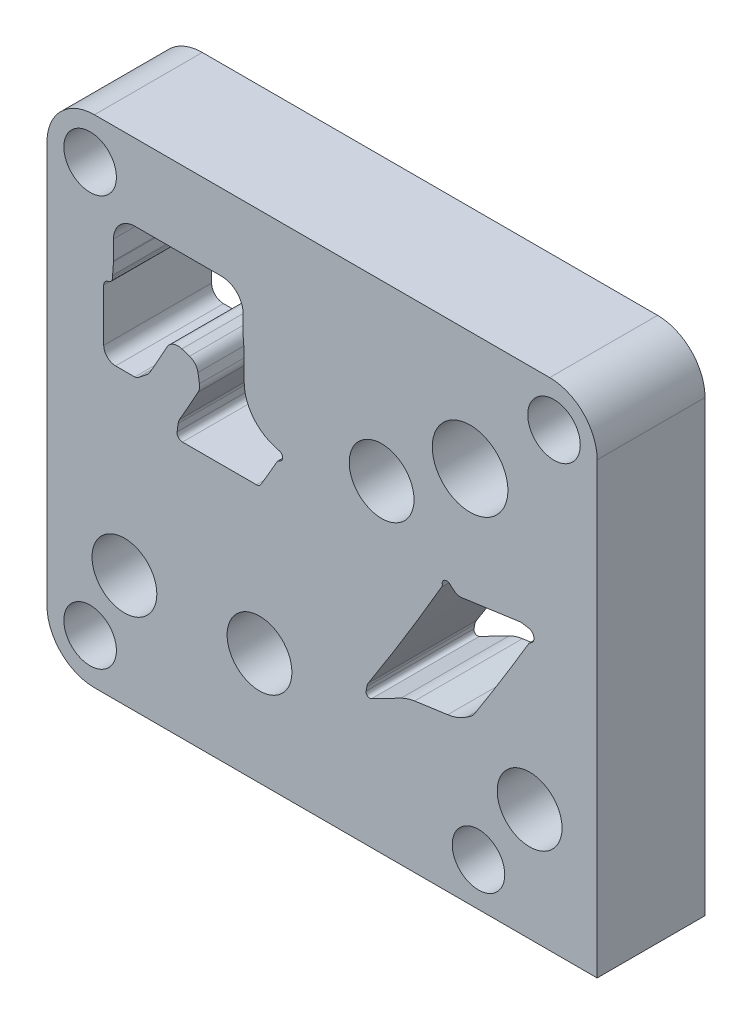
SolidWorks part; units mm, degrees
ref_plane "Front" through (0, 0, 0) normal (0, 0, 1) x (1, 0, 0)
ref_plane "Top" through (0, 0, 0) normal (0, 1, 0) x (1, 0, 0)
ref_plane "Right" through (0, 0, 0) normal (1, 0, 0) x (0, 0, -1)
ref_plane "Plane1"
sketch "Sketch1" plane through (0, 0, 0) normal (0, 0, 1) x (1, 0, 0)
  line L0 (-948.5827, 37.7447) -> (-922.8937, 74.4323) construction
  line L1 (-946.7114, 0.105) -> (-925.0793, -15.0419) construction
  line L2 (-867.3291, 76.3036) -> (-857.9601, 69.7433) construction
  line L3 (-905.6228, -11.6112) -> (-856.0888, 59.1307) construction
  line L4 (-916.6518, 77.6816) -> (-871.6997, 77.6816) construction
  line L5 (-949.9607, 33.374) -> (-949.9607, 6.347) construction
  line L6 (-896.62, 0) -> (-936.371, 0) construction
  line L7 (-921.2966, 21.3588) -> (-888.5153, 68.1753) construction
  line L8 (-928.7943, 53.4507) -> (-890.1459, 26.3888) construction
  line L9 (-896.62, -85.471) -> (-896.62, 85.471) construction
  line L11 (-998.0309, 53.975) -> (-939.2984, 53.975) construction
  line L12 (-865.5685, -19.05) -> (-1013.5235, -19.05)
  line L13 (-865.5685, -19.05) -> (-865.5685, 113.03)
  line L14 (-879.5385, 127) -> (-1013.5235, 127)
  line L15 (-1027.4935, -5.08) -> (-1027.4935, 113.03)
  line L16 (-946.531, 115.4783) -> (-946.531, 28.0626) construction
  line L17 (-936.371, -85.471) -> (-936.371, 85.471) construction
  line L18 (-936.371, 0) -> (-976.122, 0) construction
  arc A0 (-925.0793, -15.0419) -> (-905.6228, -11.6112) centre (-917.0664, -3.5984) ccw construction
  arc A1 (-857.9601, 69.7433) -> (-856.0888, 59.1307) centre (-862.3307, 63.5014) cw construction
  arc A4 (-871.6997, 77.6816) -> (-867.3291, 76.3036) centre (-871.6997, 70.0616) cw construction
  arc A5 (-916.6518, 77.6816) -> (-922.8937, 74.4323) centre (-916.6518, 70.0616) ccw construction
  arc A6 (-949.9607, 6.347) -> (-946.7114, 0.105) centre (-942.3407, 6.347) ccw construction
  arc A7 (-949.9607, 33.374) -> (-948.5827, 37.7447) centre (-942.3407, 33.374) cw construction
  arc A8 (-1013.5235, -19.05) -> (-1027.4935, -5.08) centre (-1013.5235, -5.08) cw
  arc A9 (-865.5685, 113.03) -> (-879.5385, 127) centre (-879.5385, 113.03) ccw
  arc A10 (-1013.5235, 127) -> (-1027.4935, 113.03) centre (-1013.5235, 113.03) ccw
  point P8 (-908.685, 39.37)
  point P12 (-913.6357, -23.0548)
  point P15 (-851.7181, 65.3727)
  point P18 (-903.7343, 101.7948)
  point P39 (-946.531, 53.975)
  point P45 (-1027.4935, -19.05)
  point P48 (-865.5685, 127)
  point P53 (-865.5685, -19.05)
extrude "Boss-Extrude1" add sketch "Sketch1" against normal blind 31.75 flip side to cut
ref_plane "Plane2 QU250515L_Punch1[Mounted in the strip]-2"
ref_plane "Plane1 QU250515L_Punch1[Mounted in the strip]-2"
sketch "Sketch2 QU250515L_Punch1[Mounted in the strip]-2" plane through (0, 0, 0) normal (0, 0, 1) x (1, 0, 0)
  line L0 (-907.8441, 58.3577) -> (-909.2124, 59.493)
  line L1 (-888.4186, 60.0401) -> (-905.3749, 57.6571)
  line L2 (-885.7407, 59.7257) -> (-887.4254, 60.0228)
  line L3 (-904.0985, 28.5403) -> (-902.8478, 29.4112)
  line L4 (-919.3415, 25.0155) -> (-909.5881, 26.3862)
  line L5 (-932.1542, 19.2003) -> (-923.4041, 23.7218)
  line L6 (-933.0211, 21.2739) -> (-933.2533, 20.0156)
  line L7 (-933.0211, 21.2739) -> (-933.2533, 20.0156)
  line L8 (-932.1542, 19.2003) -> (-923.4041, 23.7218)
  line L9 (-919.3415, 25.0155) -> (-909.5881, 26.3862)
  line L10 (-904.0985, 28.5403) -> (-902.8478, 29.4112)
  line L11 (-885.7407, 59.7257) -> (-887.4254, 60.0228)
  line L12 (-888.4186, 60.0401) -> (-905.3749, 57.6571)
  line L13 (-907.8441, 58.3577) -> (-909.2124, 59.493)
  arc A0 (-932.5852, 22.3726) -> (-911.0334, 57.6234) centre (-1653.9165, 487.596) ccw
  arc A1 (-911.0334, 57.6234) -> (-910.842, 58.5901) centre (-912.3524, 58.3868) ccw
  arc A2 (-909.2124, 59.493) -> (-910.842, 58.5901) centre (-909.851, 58.7234) ccw
  arc A3 (-907.8441, 58.3577) -> (-905.3749, 57.6571) centre (-905.8168, 60.8012) ccw
  arc A4 (-887.4254, 60.0228) -> (-888.4186, 60.0401) centre (-887.9768, 56.896) ccw
  arc A5 (-885.3407, 56.8535) -> (-885.7407, 59.7257) centre (-886.0054, 58.2249) ccw
  arc A6 (-885.3407, 56.8535) -> (-885.9872, 56.2588) centre (-884.6759, 55.4821) ccw
  arc A7 (-902.0249, 30.2655) -> (-885.9872, 56.2588) centre (-1614.1655, 487.596) ccw
  arc A8 (-902.8478, 29.4112) -> (-902.0249, 30.2655) centre (-904.5895, 31.9125) ccw
  arc A9 (-909.5881, 26.3862) -> (-904.0985, 28.5403) centre (-911.3556, 38.9626) ccw
  arc A10 (-919.3415, 25.0155) -> (-923.4041, 23.7218) centre (-917.574, 12.4391) ccw
  arc A11 (-933.2533, 20.0156) -> (-932.1542, 19.2003) centre (-932.504, 19.8773) ccw
  arc A12 (-932.5852, 22.3726) -> (-933.0211, 21.2739) centre (-930.0237, 20.7206) ccw
  arc A13 (-932.5852, 22.3726) -> (-933.0211, 21.2739) centre (-930.0237, 20.7206) ccw
  arc A14 (-933.2533, 20.0156) -> (-932.1542, 19.2003) centre (-932.504, 19.8773) ccw
  arc A15 (-919.3415, 25.0155) -> (-923.4041, 23.7218) centre (-917.574, 12.4391) ccw
  arc A16 (-909.5881, 26.3862) -> (-904.0985, 28.5403) centre (-911.3556, 38.9626) ccw
  arc A17 (-902.8478, 29.4112) -> (-902.0249, 30.2655) centre (-904.5895, 31.9125) ccw
  arc A18 (-902.0249, 30.2655) -> (-885.9872, 56.2588) centre (-1614.1655, 487.596) ccw
  arc A19 (-885.3407, 56.8535) -> (-885.9872, 56.2588) centre (-884.6759, 55.4821) ccw
  arc A20 (-885.3407, 56.8535) -> (-885.7407, 59.7257) centre (-886.0054, 58.2249) ccw
  arc A21 (-887.4254, 60.0228) -> (-888.4186, 60.0401) centre (-887.9768, 56.896) ccw
  arc A22 (-907.8441, 58.3577) -> (-905.3749, 57.6571) centre (-905.8168, 60.8012) ccw
  arc A23 (-909.2124, 59.493) -> (-910.842, 58.5901) centre (-909.851, 58.7234) ccw
  arc A24 (-911.0334, 57.6234) -> (-910.842, 58.5901) centre (-912.3524, 58.3868) ccw
  arc A25 (-932.5852, 22.3726) -> (-911.0334, 57.6234) centre (-1653.9165, 487.596) ccw
  circle A26 centre (-896.62, 52.07) radius 1.2065
  circle A27 centre (-904.24, 45.72) radius 5.3594
  circle A28 centre (-911.86, 35.56) radius 5.3594
  circle A40 centre (-896.62, 52.07) radius 1.2065
  circle A44 centre (-911.86, 35.56) radius 5.3594
  circle A45 centre (-904.24, 45.72) radius 5.3594
sketch "Sketch1 QU250515L_Punch1[Mounted in the strip]-2" plane through (0, 0, -4.7625) normal (0, 0, 1) x (1, 0, 0)
  line L7 (-933.3358, 21.332) -> (-933.5681, 20.0737)
  line L8 (-932.0073, 18.916) -> (-923.2572, 23.4374)
  line L9 (-919.297, 24.6985) -> (-909.5436, 26.0693)
  line L10 (-903.9156, 28.2777) -> (-902.665, 29.1485)
  line L11 (-885.6852, 60.0409) -> (-887.3698, 60.3379)
  line L12 (-888.4632, 60.357) -> (-905.4194, 57.974)
  line L13 (-907.6398, 58.604) -> (-909.0081, 59.7393)
  line L14 (-933.3358, 21.332) -> (-933.5681, 20.0737)
  line L15 (-932.0073, 18.916) -> (-923.2572, 23.4374)
  line L16 (-919.297, 24.6985) -> (-909.5436, 26.0693)
  line L17 (-903.9156, 28.2777) -> (-902.665, 29.1485)
  line L18 (-885.6852, 60.0409) -> (-887.3698, 60.3379)
  line L19 (-888.4632, 60.357) -> (-905.4194, 57.974)
  line L20 (-907.6398, 58.604) -> (-909.0081, 59.7393)
  arc A13 (-932.8541, 22.5461) -> (-933.3358, 21.332) centre (-930.0237, 20.7206) ccw
  arc A14 (-933.5681, 20.0737) -> (-932.0073, 18.916) centre (-932.504, 19.8773) ccw
  arc A15 (-919.297, 24.6985) -> (-923.2572, 23.4374) centre (-917.574, 12.4391) ccw
  arc A16 (-909.5436, 26.0693) -> (-903.9156, 28.2777) centre (-911.3556, 38.9626) ccw
  arc A17 (-902.665, 29.1485) -> (-901.7556, 30.0926) centre (-904.5895, 31.9125) ccw
  arc A18 (-901.7556, 30.0926) -> (-885.7118, 56.0957) centre (-1614.1655, 487.596) ccw
  arc A19 (-885.2011, 56.5655) -> (-885.7118, 56.0957) centre (-884.6759, 55.4821) ccw
  arc A20 (-885.2011, 56.5655) -> (-885.6852, 60.0409) centre (-886.0054, 58.2249) ccw
  arc A21 (-887.3698, 60.3379) -> (-888.4632, 60.357) centre (-887.9768, 56.896) ccw
  arc A22 (-907.6398, 58.604) -> (-905.4194, 57.974) centre (-905.8168, 60.8012) ccw
  arc A23 (-909.0081, 59.7393) -> (-911.1592, 58.5474) centre (-909.851, 58.7234) ccw
  arc A24 (-911.3104, 57.7837) -> (-911.1592, 58.5474) centre (-912.3524, 58.3868) ccw
  arc A25 (-932.8541, 22.5461) -> (-911.3104, 57.7837) centre (-1653.9165, 487.596) ccw
  arc A26 (-932.8541, 22.5461) -> (-933.3358, 21.332) centre (-930.0237, 20.7206) ccw
  arc A27 (-933.5681, 20.0737) -> (-932.0073, 18.916) centre (-932.504, 19.8773) ccw
  arc A28 (-919.297, 24.6985) -> (-923.2572, 23.4374) centre (-917.574, 12.4391) ccw
  arc A29 (-909.5436, 26.0693) -> (-903.9156, 28.2777) centre (-911.3556, 38.9626) ccw
  arc A30 (-902.665, 29.1485) -> (-901.7556, 30.0926) centre (-904.5895, 31.9125) ccw
  arc A31 (-901.7556, 30.0926) -> (-885.7118, 56.0957) centre (-1614.1655, 487.596) ccw
  arc A32 (-885.2011, 56.5655) -> (-885.7118, 56.0957) centre (-884.6759, 55.4821) ccw
  arc A33 (-885.2011, 56.5655) -> (-885.6852, 60.0409) centre (-886.0054, 58.2249) ccw
  arc A34 (-887.3698, 60.3379) -> (-888.4632, 60.357) centre (-887.9768, 56.896) ccw
  arc A35 (-907.6398, 58.604) -> (-905.4194, 57.974) centre (-905.8168, 60.8012) ccw
  arc A36 (-909.0081, 59.7393) -> (-911.1592, 58.5474) centre (-909.851, 58.7234) ccw
  arc A37 (-911.3104, 57.7837) -> (-911.1592, 58.5474) centre (-912.3524, 58.3868) ccw
  arc A38 (-932.8541, 22.5461) -> (-911.3104, 57.7837) centre (-1653.9165, 487.596) ccw
ref_plane "Plane2 QU250515L_Punch4[Mounted in the strip]-1"
ref_plane "Plane1 QU250515L_Punch4[Mounted in the strip]-1"
sketch "Sketch2 QU250515L_Punch4[Mounted in the strip]-1" plane through (0, 0, 0) normal (0, 0, 1) x (1, 0, 0)
  line L0 (-976.122, 104.521) -> (-1001.522, 104.521)
  line L1 (-987.6114, 56.8535) -> (-965.8621, 56.8535)
  line L2 (-988.5754, 60.5652) -> (-988.8709, 58.2868)
  line L3 (-982.7401, 76.596) -> (-982.3045, 73.9476)
  line L4 (-987.6832, 80.4921) -> (-985.427, 79.7432)
  line L5 (-1000.8813, 66.6897) -> (-998.2554, 68.7387)
  line L6 (-1004.697, 66.421) -> (-1001.6626, 66.421)
  line L7 (-1007.872, 98.171) -> (-1007.872, 69.596)
  line L8 (-969.772, 80.8774) -> (-969.772, 98.171)
  line L9 (-959.1552, 68.2309) -> (-960.8063, 68.7388)
  line L10 (-959.1552, 68.2309) -> (-960.8063, 68.7388)
  line L11 (-969.772, 80.8774) -> (-969.772, 98.171)
  line L12 (-1007.872, 98.171) -> (-1007.872, 69.596)
  line L13 (-1004.697, 66.421) -> (-1001.6626, 66.421)
  line L14 (-1000.8813, 66.6897) -> (-998.2554, 68.7387)
  line L15 (-987.6832, 80.4921) -> (-985.427, 79.7432)
  line L16 (-982.7401, 76.596) -> (-982.3045, 73.9476)
  line L17 (-988.5754, 60.5652) -> (-988.8709, 58.2868)
  line L18 (-987.6114, 56.8535) -> (-965.8621, 56.8535)
  line L19 (-976.122, 104.521) -> (-1001.522, 104.521)
  arc A0 (-1001.522, 104.521) -> (-1007.872, 98.171) centre (-1001.522, 98.171) ccw
  arc A1 (-969.772, 98.171) -> (-976.122, 104.521) centre (-976.122, 98.171) ccw
  arc A2 (-988.8709, 58.2868) -> (-987.6114, 56.8535) centre (-987.6114, 58.1235) ccw
  arc A3 (-988.199, 61.6856) -> (-988.5754, 60.5652) centre (-985.5527, 60.1732) ccw
  arc A4 (-988.199, 61.6856) -> (-982.7533, 71.3587) centre (-1733.4185, 487.596) ccw
  arc A5 (-982.7533, 71.3587) -> (-982.3045, 73.9476) centre (-986.2515, 73.2984) ccw
  arc A6 (-982.7401, 76.596) -> (-985.427, 79.7432) centre (-986.6871, 75.9469) ccw
  arc A7 (-987.6832, 80.4921) -> (-992.4453, 78.6287) centre (-988.9433, 76.6958) ccw
  arc A8 (-997.4801, 69.6365) -> (-992.4453, 78.6287) centre (-1733.4185, 487.596) ccw
  arc A9 (-998.2554, 68.7387) -> (-997.4801, 69.6365) centre (-1000.1305, 71.1417) ccw
  arc A10 (-1001.6626, 66.421) -> (-1000.8813, 66.6897) centre (-1001.6626, 67.691) ccw
  arc A11 (-1007.872, 69.596) -> (-1004.697, 66.421) centre (-1004.697, 69.596) ccw
  arc A12 (-969.772, 80.8774) -> (-960.8063, 68.7388) centre (-957.072, 80.8774) ccw
  arc A13 (-959.1529, 66.32) -> (-959.1552, 68.2309) centre (-959.4493, 67.2751) ccw
  arc A14 (-959.1529, 66.32) -> (-960.0222, 65.6244) centre (-958.7011, 64.8645) ccw
  arc A15 (-964.7683, 57.478) -> (-960.0222, 65.6244) centre (-1693.6675, 487.596) ccw
  arc A16 (-965.8621, 56.8535) -> (-964.7683, 57.478) centre (-965.8621, 58.1235) ccw
  arc A17 (-965.8621, 56.8535) -> (-964.7683, 57.478) centre (-965.8621, 58.1235) ccw
  arc A18 (-964.7683, 57.478) -> (-960.0222, 65.6244) centre (-1693.6675, 487.596) ccw
  arc A19 (-959.1529, 66.32) -> (-960.0222, 65.6244) centre (-958.7011, 64.8645) ccw
  arc A20 (-959.1529, 66.32) -> (-959.1552, 68.2309) centre (-959.4493, 67.2751) ccw
  arc A21 (-969.772, 80.8774) -> (-960.8063, 68.7388) centre (-957.072, 80.8774) ccw
  arc A22 (-1007.872, 69.596) -> (-1004.697, 66.421) centre (-1004.697, 69.596) ccw
  arc A23 (-1001.6626, 66.421) -> (-1000.8813, 66.6897) centre (-1001.6626, 67.691) ccw
  arc A24 (-998.2554, 68.7387) -> (-997.4801, 69.6365) centre (-1000.1305, 71.1417) ccw
  arc A25 (-997.4801, 69.6365) -> (-992.4453, 78.6287) centre (-1733.4185, 487.596) ccw
  arc A26 (-987.6832, 80.4921) -> (-992.4453, 78.6287) centre (-988.9433, 76.6958) ccw
  arc A27 (-982.7401, 76.596) -> (-985.427, 79.7432) centre (-986.6871, 75.9469) ccw
  arc A28 (-982.7533, 71.3587) -> (-982.3045, 73.9476) centre (-986.2515, 73.2984) ccw
  arc A29 (-988.199, 61.6856) -> (-982.7533, 71.3587) centre (-1733.4185, 487.596) ccw
  arc A30 (-988.199, 61.6856) -> (-988.5754, 60.5652) centre (-985.5527, 60.1732) ccw
  arc A31 (-988.8709, 58.2868) -> (-987.6114, 56.8535) centre (-987.6114, 58.1235) ccw
  arc A32 (-969.772, 98.171) -> (-976.122, 104.521) centre (-976.122, 98.171) ccw
  arc A33 (-1001.522, 104.521) -> (-1007.872, 98.171) centre (-1001.522, 98.171) ccw
  arc A34 (-974.9155, 76.2) -> (-974.9155, 76.2) centre (-976.122, 76.2) ccw
  arc A35 (-968.9846, 65.532) -> (-968.9846, 65.532) centre (-974.344, 65.532) ccw
  circle A36 centre (-979.297, 94.996) radius 5.3594
  circle A37 centre (-998.347, 94.996) radius 5.3594
sketch "Sketch1 QU250515L_Punch4[Mounted in the strip]-1" plane through (0, 0, -4.7625) normal (0, 0, 1) x (1, 0, 0)
  line L0 (-1004.697, 66.421) -> (-1001.6626, 66.421) construction
  line L1 (-1000.8813, 66.6897) -> (-998.2554, 68.7387) construction
  line L2 (-987.6832, 80.4921) -> (-985.427, 79.7432) construction
  line L3 (-982.7401, 76.596) -> (-982.3045, 73.9476) construction
  line L4 (-988.5754, 60.5652) -> (-988.8709, 58.2868) construction
  line L5 (-987.6114, 56.8535) -> (-965.8621, 56.8535) construction
  line L6 (-959.1552, 68.2309) -> (-960.8063, 68.7388) construction
  line L7 (-1004.697, 66.421) -> (-1001.6626, 66.421) construction
  line L8 (-1000.8813, 66.6897) -> (-998.2554, 68.7387) construction
  line L9 (-987.6832, 80.4921) -> (-985.427, 79.7432) construction
  line L30 (-982.7401, 76.596) -> (-982.3045, 73.9476) construction
  line L31 (-988.5754, 60.5652) -> (-988.8709, 58.2868) construction
  line L32 (-987.6114, 56.8535) -> (-965.8621, 56.8535) construction
  line L33 (-959.1552, 68.2309) -> (-960.8063, 68.7388) construction
  line L34 (-969.772, 92.419) -> (-969.772, 80.8774) construction
  line L35 (-969.772, 80.8774) -> (-969.772, 98.171) construction
  line L36 (-1007.872, 69.596) -> (-1007.872, 92.4078) construction
  line L37 (-1007.872, 98.171) -> (-1007.872, 69.596) construction
  line L38 (-1007.8974, 92.4301) -> (-1007.8974, 98.171) construction
  line L39 (-959.0611, 68.5368) -> (-960.7122, 69.0447)
  line L40 (-987.6114, 56.5334) -> (-965.8621, 56.5334)
  line L41 (-988.8928, 60.6063) -> (-989.1882, 58.3279)
  line L42 (-983.0559, 76.5441) -> (-982.6203, 73.8957)
  line L43 (-987.784, 80.1884) -> (-985.5278, 79.4394)
  line L44 (-1000.6844, 66.4374) -> (-998.0586, 68.4864)
  line L45 (-1004.697, 66.101) -> (-1001.6626, 66.101)
  line L46 (-969.7466, 98.171) -> (-969.7466, 92.5848) construction
  line L47 (-1007.872, 92.4301) -> (-1007.872, 98.171) construction
  line L48 (-969.772, 98.171) -> (-969.772, 92.5848) construction
  line L49 (-976.122, 104.521) -> (-1001.522, 104.521) construction
  line L50 (-976.122, 104.521) -> (-1001.522, 104.521) construction
  line L51 (-1007.8974, 92.5982) -> (-1007.8974, 98.171)
  line L52 (-976.122, 104.5464) -> (-1001.522, 104.5464)
  line L53 (-969.7466, 98.171) -> (-969.7466, 92.5982)
  line L54 (-1008.192, 69.596) -> (-1008.192, 92.4078) construction
  line L55 (-969.452, 92.419) -> (-969.452, 80.8774) construction
  line L56 (-1008.192, 69.596) -> (-1008.192, 88.5038)
  line L57 (-969.452, 88.5038) -> (-969.452, 80.8774)
  line L58 (-1008.1811, 88.7878) -> (-1007.9084, 92.3142)
  line L59 (-969.7356, 92.3142) -> (-969.4629, 88.7878)
  arc A0 (-1007.872, 69.596) -> (-1004.697, 66.421) centre (-1004.697, 69.596) ccw construction
  arc A1 (-1001.6626, 66.421) -> (-1000.8813, 66.6897) centre (-1001.6626, 67.691) ccw construction
  arc A2 (-998.2554, 68.7387) -> (-997.4801, 69.6365) centre (-1000.1305, 71.1417) ccw construction
  arc A3 (-997.4801, 69.6365) -> (-992.4453, 78.6287) centre (-1733.4185, 487.596) ccw construction
  arc A4 (-987.6832, 80.4921) -> (-992.4453, 78.6287) centre (-988.9433, 76.6958) ccw construction
  arc A5 (-982.7401, 76.596) -> (-985.427, 79.7432) centre (-986.6871, 75.9469) ccw construction
  arc A6 (-982.7533, 71.3587) -> (-982.3045, 73.9476) centre (-986.2515, 73.2984) ccw construction
  arc A7 (-988.199, 61.6856) -> (-982.7533, 71.3587) centre (-1733.4185, 487.596) ccw construction
  arc A8 (-988.199, 61.6856) -> (-988.5754, 60.5652) centre (-985.5527, 60.1732) ccw construction
  arc A9 (-988.8709, 58.2868) -> (-987.6114, 56.8535) centre (-987.6114, 58.1235) ccw construction
  arc A10 (-965.8621, 56.8535) -> (-964.7683, 57.478) centre (-965.8621, 58.1235) ccw construction
  arc A11 (-964.7683, 57.478) -> (-960.0222, 65.6244) centre (-1693.6675, 487.596) ccw construction
  arc A12 (-959.1529, 66.32) -> (-960.0222, 65.6244) centre (-958.7011, 64.8645) ccw construction
  arc A13 (-959.1529, 66.32) -> (-959.1552, 68.2309) centre (-959.4493, 67.2751) ccw construction
  arc A14 (-969.772, 80.8774) -> (-960.8063, 68.7388) centre (-957.072, 80.8774) ccw construction
  arc A15 (-1007.872, 69.596) -> (-1004.697, 66.421) centre (-1004.697, 69.596) ccw construction
  arc A16 (-1001.6626, 66.421) -> (-1000.8813, 66.6897) centre (-1001.6626, 67.691) ccw construction
  arc A18 (-998.2554, 68.7387) -> (-997.4801, 69.6365) centre (-1000.1305, 71.1417) ccw construction
  arc A19 (-997.4801, 69.6365) -> (-992.4453, 78.6287) centre (-1733.4185, 487.596) ccw construction
  arc A20 (-987.6832, 80.4921) -> (-992.4453, 78.6287) centre (-988.9433, 76.6958) ccw construction
  arc A23 (-982.7401, 76.596) -> (-985.427, 79.7432) centre (-986.6871, 75.9469) ccw construction
  arc A24 (-982.7533, 71.3587) -> (-982.3045, 73.9476) centre (-986.2515, 73.2984) ccw construction
  arc A27 (-988.199, 61.6856) -> (-982.7533, 71.3587) centre (-1733.4185, 487.596) ccw construction
  arc A28 (-988.199, 61.6856) -> (-988.5754, 60.5652) centre (-985.5527, 60.1732) ccw construction
  arc A32 (-988.8709, 58.2868) -> (-987.6114, 56.8535) centre (-987.6114, 58.1235) ccw construction
  arc A33 (-965.8621, 56.8535) -> (-964.7683, 57.478) centre (-965.8621, 58.1235) ccw construction
  arc A51 (-964.7683, 57.478) -> (-960.0222, 65.6244) centre (-1693.6675, 487.596) ccw construction
  arc A52 (-959.1529, 66.32) -> (-960.0222, 65.6244) centre (-958.7011, 64.8645) ccw construction
  arc A53 (-959.1529, 66.32) -> (-959.1552, 68.2309) centre (-959.4493, 67.2751) ccw construction
  arc A54 (-969.772, 80.8774) -> (-960.8063, 68.7388) centre (-957.072, 80.8774) ccw construction
  arc A55 (-969.452, 80.8774) -> (-960.7122, 69.0447) centre (-957.072, 80.8774) ccw
  arc A56 (-959.058, 66.0144) -> (-959.0611, 68.5368) centre (-959.4493, 67.2751) ccw
  arc A57 (-959.058, 66.0144) -> (-959.7448, 65.4648) centre (-958.7011, 64.8645) ccw
  arc A58 (-964.4927, 57.3154) -> (-959.7448, 65.4648) centre (-1693.6675, 487.596) ccw
  arc A59 (-965.8621, 56.5334) -> (-964.4927, 57.3154) centre (-965.8621, 58.1235) ccw
  arc A60 (-989.1882, 58.3279) -> (-987.6114, 56.5334) centre (-987.6114, 58.1235) ccw
  arc A61 (-988.4769, 61.8444) -> (-988.8928, 60.6063) centre (-985.5527, 60.1732) ccw
  arc A62 (-988.4769, 61.8444) -> (-983.0332, 71.5139) centre (-1733.4185, 487.596) ccw
  arc A63 (-983.0332, 71.5139) -> (-982.6203, 73.8957) centre (-986.2515, 73.2984) ccw
  arc A64 (-983.0559, 76.5441) -> (-985.5278, 79.4394) centre (-986.6871, 75.9469) ccw
  arc A65 (-987.784, 80.1884) -> (-992.1652, 78.474) centre (-988.9433, 76.6958) ccw
  arc A66 (-997.2018, 69.4784) -> (-992.1652, 78.474) centre (-1733.4185, 487.596) ccw
  arc A67 (-998.0586, 68.4864) -> (-997.2018, 69.4784) centre (-1000.1305, 71.1417) ccw
  arc A68 (-1001.6626, 66.101) -> (-1000.6844, 66.4374) centre (-1001.6626, 67.691) ccw
  arc A69 (-1008.192, 69.596) -> (-1004.697, 66.101) centre (-1004.697, 69.596) ccw
  arc A70 (-969.772, 98.171) -> (-976.122, 104.521) centre (-976.122, 98.171) ccw construction
  arc A71 (-1001.522, 104.521) -> (-1007.872, 98.171) centre (-1001.522, 98.171) ccw construction
  arc A72 (-969.772, 98.171) -> (-976.122, 104.521) centre (-976.122, 98.171) ccw construction
  arc A73 (-1001.522, 104.521) -> (-1007.872, 98.171) centre (-1001.522, 98.171) ccw construction
  arc A74 (-1001.522, 104.5464) -> (-1007.8974, 98.171) centre (-1001.522, 98.171) ccw
  arc A75 (-969.7466, 98.171) -> (-976.122, 104.5464) centre (-976.122, 98.171) ccw
  arc A76 (-1008.192, 88.5038) -> (-1008.1811, 88.7878) centre (-1004.509, 88.5038) cw
  arc A77 (-1007.8974, 92.5982) -> (-1007.9084, 92.3142) centre (-1011.5804, 92.5982) cw
  arc A78 (-969.7466, 92.5982) -> (-969.7356, 92.3142) centre (-966.0636, 92.5982) ccw
  arc A79 (-969.452, 88.5038) -> (-969.4629, 88.7878) centre (-973.135, 88.5038) ccw
  point P95 (-1008.192, 88.646)
  point P100 (-1007.8974, 92.456)
hole_wizard "Hole1" positions "Point_Sketch" profile "Profil_Sketch" hole size "Ø0.15" standard "ISO"
sketch "Point_Sketch" plane through (-1008.3513, 24.5711, 0) normal (0, 0, -1) x (1, 0, 0)
  point P0 (3.6543, 10.6011)
  point P2 (43.4053, 10.6011)
  point P4 (122.9073, 10.6011)
  point P6 (79.3463, -51.3241)
  point P8 (105.3813, -67.5039)
sketch "Profil_Sketch" plane through (-1004.697, 13.97, 0) normal (1, 0, 0) x (0, -1, 0)
  line L0 (0, 0) -> (0, 31.75)
  line L1 (0, 31.75) -> (9.5377, 31.75)
  line L2 (9.5377, 31.75) -> (9.5377, 0)
  line L5 (9.5377, 0) -> (0, 0)
  line L11 (0, -6.35) -> (0, 107.95) construction
  dimension "Diameter" = 19.0754
  dimension "Thru Hole Depth" = 31.75
other "usin_DL090<1>"
hole_wizard "Hole11" positions "Point_Sketch1" profile "Profil_Sketch1" counterbore size "1/4" standard "ANSI Inch"
sketch "Point_Sketch1" plane through (-913.3626, 0.935, 0) normal (0, 0, -1) x (1, 0, 0)
  point P0 (12.8691, 7.285)
  point P2 (35.0941, -113.365)
  point P4 (-101.4309, -113.365)
  point P6 (-101.4309, 7.285)
sketch "Profil_Sketch1" plane through (-900.4935, -6.35, 0) normal (1, 0, 0) x (0, -1, 0)
  line L0 (0, 0) -> (0, 31.75)
  line L1 (0, 31.75) -> (5.1562, 31.75)
  line L3 (5.1562, 31.75) -> (5.1562, 17.526)
  line L4 (5.1562, 17.526) -> (7.7343, 17.526)
  line L5 (7.7343, 17.526) -> (7.7343, 0)
  line L7 (7.7343, 0) -> (0, 0)
  line L11 (0, -6.35) -> (0, 107.95) construction
  dimension "Diameter" = 10.3124
  dimension "Thru Hole Depth" = 31.75
  dimension "L1" = 17.526
other "usin_LS160_.375-16x1.75-SHCS<1>"
extrude "Cut-Extrude1 QU250515L_Punch1[Mounted in the strip]-2" cut sketch "Sketch1 QU250515L_Punch1[Mounted in the strip]-2" against normal through all and the other way through all
extrude "Cut-Extrude1 QU250515L_Punch4[Mounted in the strip]-1" cut sketch "Sketch1 QU250515L_Punch4[Mounted in the strip]-1" against normal through all and the other way through all
sketch "Sketch2" plane through (0, 0, 0) normal (0, 0, 1) x (1, 0, 0)
  line L0 (-1008.192, 88.5038) -> (-1008.192, 69.596) construction
  line L1 (-1004.697, 66.101) -> (-1001.6626, 66.101) construction
  line L2 (-1008.192, 88.0857) -> (-1008.192, 69.596)
  line L3 (-1004.697, 66.101) -> (-1007.298, 66.101)
  line L5 (-1010.793, 84.963) -> (-1010.793, 69.596)
  line L7 (-976.122, 85.471) -> (-1015.873, 85.471) construction
  line L8 (-1009.523, 85.471) -> (-1009.523, 80.8774) construction
  arc A0 (-1008.192, 69.596) -> (-1004.697, 66.101) centre (-1004.697, 69.596) ccw construction
  arc A1 (-1008.192, 69.596) -> (-1004.697, 66.101) centre (-1004.697, 69.596) ccw
  arc A2 (-1009.4925, 86.5243) -> (-1008.192, 88.0857) centre (-1009.7795, 88.0857) ccw
  arc A3 (-1009.4925, 86.5243) -> (-1010.793, 84.963) centre (-1009.2055, 84.963) ccw
  arc A4 (-1007.298, 66.101) -> (-1010.793, 69.596) centre (-1007.298, 69.596) cw
  dimension "D1" = 1.5875
  dimension "D2" = 0.508
  dimension "D3" = 1.27
extrude "Cut-Extrude1" cut sketch "Sketch2" against normal through all
other "Move Face1" parameters "D1"=1.5875
